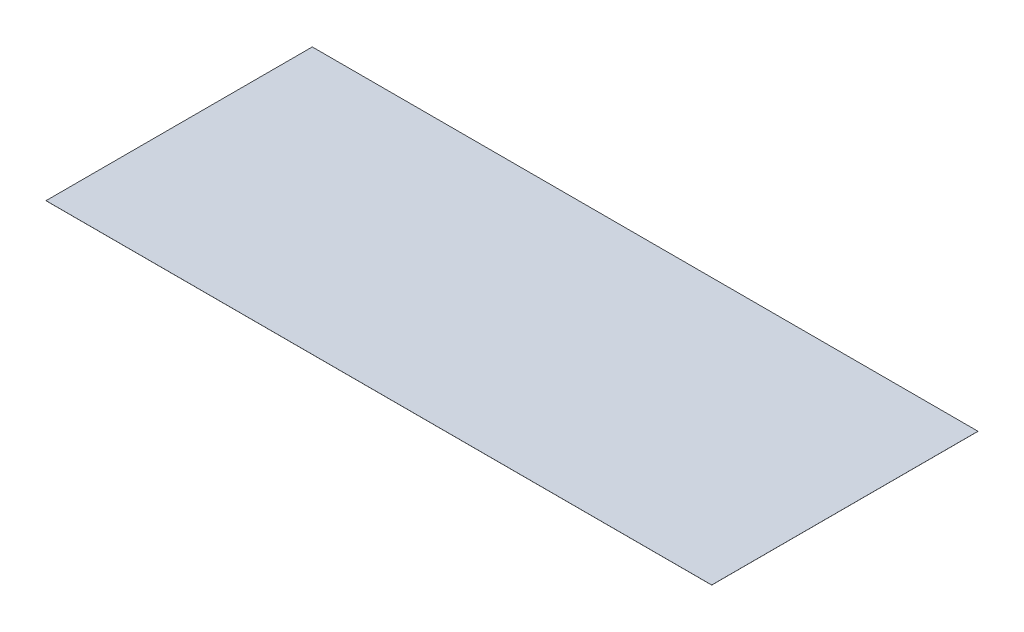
SolidWorks part; units mm, degrees
ref_plane "Plan de face" through (0, 0, 0) normal (0, 0, 1) x (1, 0, 0)
ref_plane "Plan de dessus" through (0, 0, 0) normal (0, 1, 0) x (1, 0, 0)
ref_plane "Plan de droite" through (0, 0, 0) normal (1, 0, 0) x (0, 0, -1)
sketch "Esquisse1" plane through (0, 0, 0) normal (0, 0, 1) x (1, 0, 0)
  line L3 (-10000, 0) -> (0, 0)
  dimension "D1" = 10000
extrude "Extru.-Mince1" add sketch "Esquisse1" along normal blind 4000 thin
